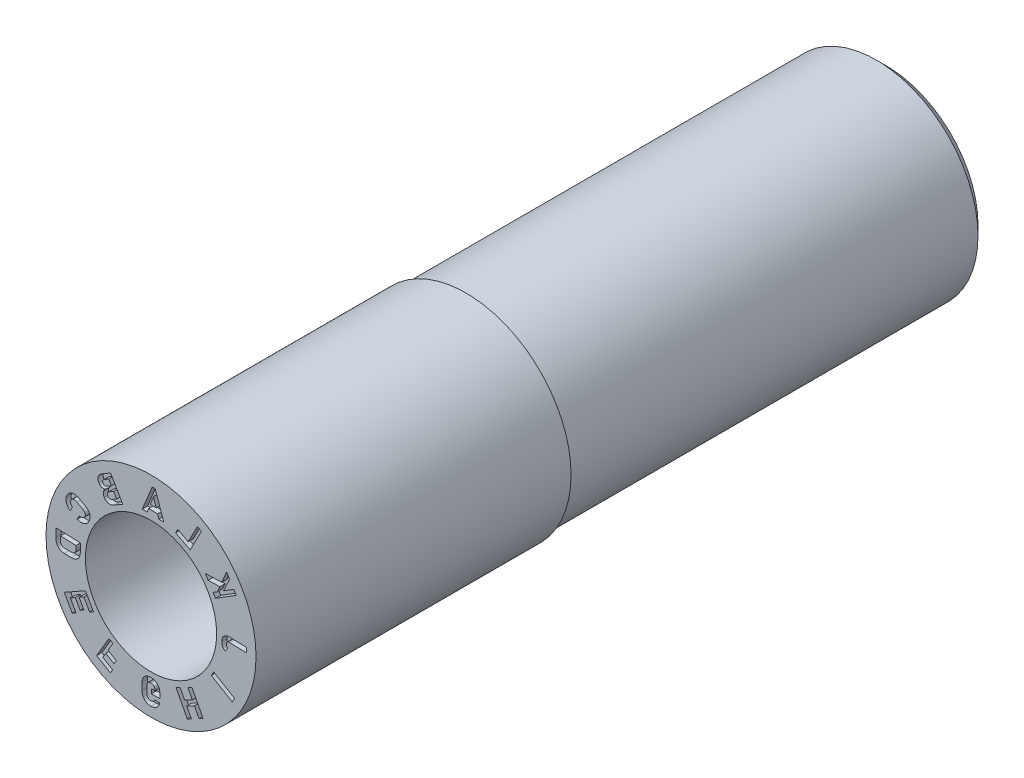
SolidWorks part; units mm, degrees
ref_plane "Front Plane" through (0, 0, 0) normal (0, 0, 1) x (1, 0, 0)
ref_plane "Top Plane" through (0, 0, 0) normal (0, 1, 0) x (1, 0, 0)
ref_plane "Right Plane" through (0, 0, 0) normal (1, 0, 0) x (0, 0, -1)
sketch "Sketch1" plane through (0, 0, 0) normal (1, 0, 0) x (0, 0, -1)
  line L2 (0, 2) -> (0, 1.25)
  line L3 (13.75, 2) -> (0, 2)
  line L4 (-3.7979, 0) -> (49996.2021, 0) construction
  line L8 (11, 0.7) -> (2.3, 0.7)
  line L9 (2.3, 1.25) -> (2.3, 0.7)
  line L10 (2.3, 1.25) -> (0, 1.25)
  line L12 (14, 1) -> (14, 1.75)
  line L16 (14, 1.75) -> (13.75, 2)
  line L17 (14, 1) -> (11, 1)
  line L18 (11, 0.7) -> (11, 1)
  dimension "D1" = 14
  dimension "D2" = 45
  dimension "D3" = 0.25
  dimension "D4" = 4
  dimension "D5" = 2.5
  dimension "D6" = 2.3
  dimension "D7" = 1.4
  dimension "D8" = 2
  dimension "D9" = 3
revolve "Revolve1" add sketch "Sketch1" angle 360 about L4
sketch "Sketch5" plane through (0, 0, 0) normal (1, 0, 0) x (0, 0, -1)
  line L0 (0, 0) -> (50000, 0) construction
  line L1 (0, 2) -> (0, -2) construction
  line L2 (6, 1.935) -> (14, 1.935)
  line L3 (6, 1.935) -> (6, 2.935)
  line L4 (6, 2.935) -> (14, 2.935)
  line L5 (14, 1.935) -> (14, 2.935)
  line L6 (14, -1.75) -> (14, 1.75) construction
  line L7 (13.75, 2) -> (0, 2) construction
  dimension "D1" = 6
  dimension "D2" = 0.065
  dimension "D3" = 1
revolve "Cut-Revolve1" cut sketch "Sketch5" angle 360 about L0
sketch "Sketch2" plane through (0, 0, 0) normal (0, 0, 1) x (1, 0, 0)
  line L0 (1.3812, 0.777) -> (1.4966, 1.0272)
  line L1 (1.4966, 1.0272) -> (1.4384, 1.1208)
  line L2 (1.4384, 1.1208) -> (1.3483, 0.9023)
  line L4 (1.623, 0.8241) -> (1.5767, 0.8985)
  line L5 (1.5767, 0.8985) -> (1.3812, 0.777)
  line L6 (1.182, 0.653) -> (1.2283, 0.5786)
  line L7 (1.2283, 0.5786) -> (1.623, 0.8241)
  line L8 (1.311, 0.8117) -> (1.2675, 0.7062)
  line L9 (1.3483, 0.9023) -> (1.0334, 0.8919)
  line L10 (1.0334, 0.8919) -> (1.0883, 0.8036)
  line L11 (1.0883, 0.8036) -> (1.311, 0.8117)
  line L12 (0.9605, 1.5481) -> (0.8828, 1.5886)
  line L13 (0.8828, 1.5886) -> (0.707, 1.251)
  line L15 (0.7457, 1.1356) -> (0.9605, 1.5481)
  line L16 (0.707, 1.251) -> (0.5084, 1.3544)
  line L17 (0.5084, 1.3544) -> (0.4693, 1.2795)
  line L18 (0.4693, 1.2795) -> (0.7457, 1.1356)
  line L20 (0.0794, 1.8106) -> (0.0239, 1.8122)
  line L21 (0.0239, 1.8122) -> (-0.1669, 1.3536)
  line L22 (-0.1669, 1.3536) -> (-0.0728, 1.3509)
  line L23 (-0.0728, 1.3509) -> (-0.0446, 1.4244)
  line L24 (0.0473, 1.6644) -> (0.0982, 1.5045)
  line L25 (0.1492, 1.3444) -> (0.2432, 1.3418)
  line L26 (0.2432, 1.3418) -> (0.0794, 1.8106)
  line L27 (0.0982, 1.5045) -> (-0.0127, 1.5077)
  line L28 (-0.7112, 1.3713) -> (-0.6555, 1.2753)
  line L29 (-0.0446, 1.4244) -> (0.1253, 1.4195)
  line L30 (0.1253, 1.4195) -> (0.1492, 1.3444)
  line L31 (-0.6555, 1.2753) -> (-0.7406, 1.2259)
  line L32 (-0.8224, 1.2419) -> (-0.8228, 1.2429)
  line L33 (-0.7964, 1.3219) -> (-0.7112, 1.3713)
  line L34 (-1.3691, -0.7036) -> (-1.2787, -0.6528)
  line L35 (-0.7534, 1.4439) -> (-0.8385, 1.3945)
  line L36 (-0.8882, 1.4801) -> (-0.8031, 1.5295)
  line L37 (-0.818, -1.3014) -> (-0.7245, -1.1427)
  line L38 (-0.77, 1.6457) -> (-0.9328, 1.5512)
  line L39 (-0.892, 1.1876) -> (-0.8916, 1.1867)
  line L40 (-0.7058, 1.1493) -> (-0.6741, 1.1676)
  line L41 (0.8268, -1.3944) -> (0.9151, -1.5638)
  line L43 (-0.8031, 1.5295) -> (-0.7534, 1.4439)
  line L44 (-0.6741, 1.1676) -> (-0.5383, 1.2465)
  line L45 (-0.5383, 1.2465) -> (-0.77, 1.6457)
  line L46 (-1.2573, 0.8653) -> (-1.3692, 0.926)
  line L47 (-1.5403, 0.6387) -> (-1.497, 0.7183)
  line L48 (-1.4125, 0.8464) -> (-1.3006, 0.7857)
  line L49 (-1.3623, 0.6452) -> (-1.4056, 0.5655)
  line L50 (-1.4288, 0.1216) -> (-1.4309, 0.0536)
  line L51 (-1.5131, -0.0341) -> (-1.6497, -0.0298)
  line L52 (-1.7262, 0.063) -> (-1.7241, 0.131)
  line L53 (0.641, -1.3967) -> (0.5545, -1.2307)
  line L54 (-1.8055, 0.2211) -> (-1.8104, 0.0677)
  line L55 (-1.6501, -0.1204) -> (-1.5186, -0.1246)
  line L56 (-1.3466, 0.0532) -> (-1.3418, 0.2063)
  line L57 (1.2675, 0.7062) -> (1.182, 0.653)
  line L59 (-1.7241, 0.131) -> (-1.4288, 0.1216)
  line L61 (-1.3418, 0.2063) -> (-1.8055, 0.2211)
  line L63 (-1.5355, -0.7973) -> (-1.4423, -0.7449)
  line L65 (-1.2482, -0.5355) -> (-1.6515, -0.7625)
  line L66 (-1.2787, -0.6528) -> (-1.1694, -0.8469)
  line L67 (-1.1694, -0.8469) -> (-1.0961, -0.8056)
  line L68 (-1.0961, -0.8056) -> (-1.2482, -0.5355)
  line L70 (-1.4423, -0.7449) -> (-1.3502, -0.9085)
  line L71 (-1.3502, -0.9085) -> (-1.277, -0.8672)
  line L72 (-1.277, -0.8672) -> (-1.3691, -0.7036)
  line L74 (-1.6515, -0.7625) -> (-1.4995, -1.0326)
  line L75 (-1.4995, -1.0326) -> (-1.4263, -0.9914)
  line L76 (-1.4263, -0.9914) -> (-1.5355, -0.7973)
  line L79 (-0.9173, -1.4698) -> (-0.8608, -1.3739)
  line L80 (-0.7245, -1.1427) -> (-0.7999, -1.0984)
  line L81 (-0.7999, -1.0984) -> (-1.0354, -1.4981)
  line L82 (-0.8608, -1.3739) -> (-0.7037, -1.4664)
  line L83 (-0.7037, -1.4664) -> (-0.661, -1.3939)
  line L84 (-0.661, -1.3939) -> (-0.818, -1.3014)
  line L86 (-1.0354, -1.4981) -> (-0.7729, -1.6527)
  line L87 (-0.7729, -1.6527) -> (-0.7301, -1.5801)
  line L88 (-0.7301, -1.5801) -> (-0.9173, -1.4698)
  line L90 (0.1682, -1.6069) -> (0.168, -1.5162)
  line L91 (-0.1713, -1.5063) -> (-0.1712, -1.6431)
  line L92 (0.1643, -1.6783) -> (0.0699, -1.6784)
  line L93 (-0.0806, -1.6431) -> (-0.0807, -1.5062)
  line L94 (0.0774, -1.5151) -> (0.0774, -1.5227)
  line L95 (0.0774, -1.5227) -> (0.0073, -1.5228)
  line L96 (0.0073, -1.5228) -> (0.0074, -1.607)
  line L97 (0.0074, -1.607) -> (0.1682, -1.6069)
  line L98 (0.9151, -1.5638) -> (0.9923, -1.5236)
  line L99 (0.9923, -1.5236) -> (0.7789, -1.1138)
  line L100 (0.7789, -1.1138) -> (0.7016, -1.1541)
  line L101 (0.7016, -1.1541) -> (0.7881, -1.3201)
  line L102 (0.6908, -1.6807) -> (0.7679, -1.6405)
  line L103 (0.7679, -1.6405) -> (0.6797, -1.471)
  line L104 (0.5545, -1.2307) -> (0.4774, -1.2709)
  line L105 (0.4774, -1.2709) -> (0.6908, -1.6807)
  line L106 (0.6797, -1.471) -> (0.8268, -1.3944)
  line L108 (0.7881, -1.3201) -> (0.641, -1.3967)
  line L110 (1.1943, -0.6555) -> (1.1481, -0.7334)
  line L111 (1.1481, -0.7334) -> (1.5472, -0.97)
  line L112 (1.5472, -0.97) -> (1.5934, -0.8921)
  line L113 (1.5934, -0.8921) -> (1.1943, -0.6555)
  line L114 (1.4082, -0.2013) -> (1.4621, -0.1312)
  line L115 (0, 0) -> (0, 2.3765) construction
  line L116 (0, 0) -> (1.1882, 2.0581) construction
  line L117 (0, 0) -> (2.0581, 1.1882) construction
  line L118 (0, 0) -> (2.3765, 0) construction
  line L119 (0, 0) -> (2.0581, -1.1882) construction
  line L120 (0, 0) -> (1.1882, -2.0581) construction
  line L121 (0, 0) -> (0, -2.3765) construction
  line L122 (0, 0) -> (-1.1882, -2.0581) construction
  line L123 (0, 0) -> (-2.0581, -1.1882) construction
  line L124 (0, 0) -> (-2.3765, 0) construction
  line L125 (0, 0) -> (-2.0581, 1.1882) construction
  line L126 (0, 0) -> (-1.1882, 2.0581) construction
  line L127 (1.5023, -0.0184) -> (1.8183, -0.027)
  line L128 (1.8183, -0.027) -> (1.8208, 0.0635)
  line L129 (1.8208, 0.0635) -> (1.5044, 0.0721)
  line L130 (-0.0127, 1.5077) -> (0.0473, 1.6644)
  circle A54 centre (0, 0) radius 1.3646 construction
  spline S0 degree 3 poles (-0.7406, 1.2259) (-0.7483, 1.2215) (-0.7602, 1.2161) (-0.7766, 1.2138) (-0.7878, 1.2148) (-0.7982, 1.218) (-0.8111, 1.226) (-0.8185, 1.2351) (-0.8224, 1.2419) knots 0 0 0 0 0.283177 0.406051 0.522898 0.636531 0.750638 1 1 1 1
  spline S1 degree 3 poles (-0.8228, 1.2429) (-0.8255, 1.2476) (-0.829, 1.2548) (-0.8312, 1.265) (-0.8316, 1.2722) (-0.8309, 1.2794) (-0.8294, 1.2863) (-0.8263, 1.293) (-0.8224, 1.2995) (-0.8174, 1.3057) (-0.8091, 1.3138) (-0.8016, 1.3188) (-0.7964, 1.3219) knots 0 0 0 0 0.172443 0.251642 0.328086 0.402715 0.47761 0.553924 0.633837 0.717732 0.805932 1 1 1 1
  spline S2 degree 3 poles (-0.8385, 1.3945) (-0.8454, 1.3905) (-0.8563, 1.3857) (-0.8712, 1.3839) (-0.8814, 1.3849) (-0.891, 1.3883) (-0.9031, 1.3958) (-0.9096, 1.4048) (-0.9135, 1.4111) knots 0 0 0 0 0.277909 0.398836 0.514793 0.628277 0.744294 1 1 1 1
  spline S3 degree 3 poles (-0.9135, 1.4111) (-0.9168, 1.4169) (-0.9207, 1.4263) (-0.9206, 1.4394) (-0.9184, 1.4487) (-0.9139, 1.4575) (-0.9048, 1.4693) (-0.895, 1.4759) (-0.8882, 1.4801) knots 0 0 0 0 0.243539 0.354356 0.466789 0.583916 0.708822 1 1 1 1
  spline S4 degree 3 poles (-0.9328, 1.5512) (-0.9449, 1.5443) (-0.9615, 1.5327) (-0.9804, 1.5145) (-0.9916, 1.5004) (-1.0005, 1.4858) (-1.007, 1.4706) (-1.0108, 1.4548) (-1.0121, 1.4386) (-1.011, 1.4221) (-1.0058, 1.3992) (-0.9985, 1.3826) (-0.9922, 1.3721) knots 0 0 0 0 0.194841 0.282947 0.366427 0.445852 0.522292 0.597128 0.672122 0.748837 0.828157 1 1 1 1
  spline S5 degree 3 poles (-0.9922, 1.3721) (-0.9878, 1.3648) (-0.9807, 1.3543) (-0.9687, 1.343) (-0.9592, 1.3359) (-0.949, 1.3303) (-0.9383, 1.326) (-0.9268, 1.3232) (-0.9149, 1.3219) (-0.9026, 1.322) (-0.8852, 1.3241) (-0.8722, 1.3278) (-0.8636, 1.331) knots 0 0 0 0 0.172529 0.253083 0.332554 0.410188 0.487931 0.566064 0.646434 0.729378 0.814892 1 1 1 1
  spline S6 degree 3 poles (-0.8636, 1.331) (-0.8713, 1.325) (-0.8818, 1.3153) (-0.8931, 1.3004) (-0.8996, 1.2889) (-0.9048, 1.277) (-0.908, 1.2648) (-0.9097, 1.2522) (-0.9095, 1.2395) (-0.9077, 1.2265) (-0.9029, 1.2087) (-0.8969, 1.1959) (-0.892, 1.1876) knots 0 0 0 0 0.18028 0.26392 0.345728 0.425166 0.503121 0.580165 0.658737 0.739149 0.822201 1 1 1 1
  spline S7 degree 3 poles (-0.8916, 1.1867) (-0.8854, 1.1761) (-0.8748, 1.1612) (-0.8572, 1.1454) (-0.8433, 1.1361) (-0.8285, 1.1291) (-0.8128, 1.1247) (-0.7963, 1.1226) (-0.7791, 1.1232) (-0.7613, 1.126) (-0.7361, 1.1334) (-0.7178, 1.1423) (-0.7058, 1.1493) knots 0 0 0 0 0.172357 0.251846 0.328866 0.404201 0.478853 0.555423 0.635018 0.718404 0.805968 1 1 1 1
  spline S8 degree 3 poles (-1.1854, 0.6351) (-1.1814, 0.6426) (-1.1758, 0.6539) (-1.17, 0.6694) (-1.1663, 0.6806) (-1.1635, 0.6918) (-1.1615, 0.7028) (-1.1604, 0.7137) (-1.1599, 0.7245) (-1.1602, 0.7351) (-1.1614, 0.7455) (-1.1632, 0.7557) (-1.166, 0.7656) (-1.1693, 0.7754) (-1.1736, 0.7849) (-1.1785, 0.7943) (-1.1843, 0.8034) (-1.1908, 0.8122) (-1.1982, 0.8206) (-1.2061, 0.829) (-1.215, 0.8368) (-1.2245, 0.8445) (-1.2384, 0.8543) (-1.2496, 0.861) (-1.2573, 0.8653) knots 0 0 0 0 0.093263 0.13764 0.18074 0.222667 0.263368 0.303292 0.342581 0.381223 0.419433 0.457118 0.494381 0.531982 0.569989 0.608386 0.647662 0.687699 0.728383 0.77014 0.813349 0.857582 0.903517 1 1 1 1
  spline S9 degree 3 poles (-1.3692, 0.926) (-1.377, 0.9303) (-1.3887, 0.9359) (-1.4046, 0.9423) (-1.4162, 0.946) (-1.4275, 0.9492) (-1.4388, 0.9514) (-1.45, 0.9528) (-1.461, 0.9535) (-1.4717, 0.9534) (-1.4823, 0.9525) (-1.4926, 0.951) (-1.5027, 0.9486) (-1.5125, 0.9453) (-1.5222, 0.9415) (-1.5315, 0.9368) (-1.5406, 0.9313) (-1.5495, 0.9251) (-1.5579, 0.9181) (-1.5661, 0.9104) (-1.5739, 0.902) (-1.5814, 0.8928) (-1.5911, 0.8794) (-1.5977, 0.8687) (-1.6017, 0.8612) knots 0 0 0 0 0.096578 0.142249 0.186561 0.229482 0.271363 0.312409 0.352283 0.391447 0.430114 0.467872 0.505557 0.543308 0.580854 0.618955 0.657544 0.696822 0.736672 0.777602 0.819526 0.862539 0.906791 1 1 1 1
  spline S10 degree 3 poles (-1.6017, 0.8612) (-1.6083, 0.849) (-1.6164, 0.8299) (-1.6215, 0.8033) (-1.6229, 0.7836) (-1.6216, 0.764) (-1.6176, 0.7446) (-1.611, 0.7256) (-1.6018, 0.7069) (-1.59, 0.6888) (-1.5706, 0.6647) (-1.553, 0.6487) (-1.5403, 0.6387) knots 0 0 0 0 0.164327 0.242586 0.319786 0.397014 0.474298 0.553007 0.634808 0.719759 0.808514 1 1 1 1
  spline S11 degree 3 poles (-1.497, 0.7183) (-1.5027, 0.7231) (-1.5103, 0.7309) (-1.5189, 0.7421) (-1.524, 0.7507) (-1.528, 0.7593) (-1.5311, 0.7679) (-1.5329, 0.7767) (-1.5336, 0.7855) (-1.5333, 0.7942) (-1.531, 0.8058) (-1.5279, 0.8142) (-1.5248, 0.8195) knots 0 0 0 0 0.19458 0.285089 0.372105 0.454905 0.535045 0.612398 0.689463 0.765515 0.841075 1 1 1 1
  spline S12 degree 3 poles (-1.5248, 0.8195) (-1.5212, 0.8262) (-1.5149, 0.8355) (-1.5046, 0.8458) (-1.4963, 0.8517) (-1.4874, 0.8563) (-1.4779, 0.8592) (-1.4679, 0.8608) (-1.4574, 0.8609) (-1.4466, 0.8595) (-1.4312, 0.8553) (-1.4199, 0.8506) (-1.4125, 0.8464) knots 0 0 0 0 0.174576 0.254606 0.331699 0.406966 0.481706 0.558069 0.637336 0.720087 0.807714 1 1 1 1
  spline S13 degree 3 poles (-1.3006, 0.7857) (-1.2932, 0.7817) (-1.2829, 0.7749) (-1.2711, 0.7642) (-1.2641, 0.7559) (-1.2586, 0.7471) (-1.2545, 0.7379) (-1.252, 0.7283) (-1.2509, 0.7184) (-1.2514, 0.7082) (-1.2543, 0.694) (-1.2586, 0.6835) (-1.2623, 0.6768) knots 0 0 0 0 0.193323 0.280391 0.363186 0.441772 0.517736 0.59205 0.667164 0.744174 0.824716 1 1 1 1
  spline S14 degree 3 poles (-1.2623, 0.6768) (-1.2652, 0.6715) (-1.2704, 0.6639) (-1.2791, 0.6557) (-1.2861, 0.6504) (-1.2938, 0.6463) (-1.3021, 0.6429) (-1.311, 0.6407) (-1.3204, 0.6395) (-1.3303, 0.6393) (-1.3445, 0.6404) (-1.3552, 0.643) (-1.3623, 0.6452) knots 0 0 0 0 0.160107 0.236417 0.312415 0.388471 0.465746 0.544991 0.627212 0.713455 0.803972 1 1 1 1
  spline S15 degree 3 poles (-1.4056, 0.5655) (-1.3902, 0.5603) (-1.3671, 0.5545) (-1.3363, 0.5513) (-1.3147, 0.5514) (-1.294, 0.5538) (-1.2745, 0.5586) (-1.2561, 0.5658) (-1.2389, 0.5752) (-1.2232, 0.587) (-1.2036, 0.6057) (-1.1921, 0.6229) (-1.1854, 0.6351) knots 0 0 0 0 0.191937 0.280787 0.365796 0.447661 0.526184 0.603468 0.680472 0.757424 0.835658 1 1 1 1
  spline S16 degree 3 poles (-1.4309, 0.0536) (-1.4311, 0.0468) (-1.432, 0.0369) (-1.4347, 0.0243) (-1.437, 0.0157) (-1.4404, 0.0078) (-1.4441, 0.0004) (-1.4485, -0.0064) (-1.4536, -0.0124) (-1.4593, -0.0177) (-1.4654, -0.0224) (-1.4721, -0.0263) (-1.4793, -0.0294) (-1.487, -0.0317) (-1.4983, -0.034) (-1.5071, -0.0343) (-1.5131, -0.0341) knots 0 0 0 0 0.148914 0.217405 0.28322 0.345357 0.405771 0.464641 0.52207 0.578854 0.634762 0.691563 0.748186 0.807299 0.868222 1 1 1 1
  spline S17 degree 3 poles (-1.6497, -0.0298) (-1.6556, -0.0295) (-1.6645, -0.0287) (-1.6756, -0.0258) (-1.6831, -0.0229) (-1.6902, -0.0193) (-1.6966, -0.0151) (-1.7025, -0.01) (-1.7078, -0.0043) (-1.7124, 0.0021) (-1.7165, 0.009) (-1.7197, 0.0166) (-1.7224, 0.0248) (-1.7244, 0.0335) (-1.7261, 0.0463) (-1.7265, 0.0562) (-1.7262, 0.063) knots 0 0 0 0 0.131618 0.192912 0.251526 0.30945 0.365197 0.42148 0.478703 0.53616 0.594459 0.654456 0.717115 0.782747 0.851228 1 1 1 1
  spline S18 degree 3 poles (-1.8104, 0.0677) (-1.8108, 0.0584) (-1.8104, 0.0446) (-1.8091, 0.0266) (-1.8074, 0.0139) (-1.8051, 0.0016) (-1.802, -0.0101) (-1.7985, -0.0213) (-1.7943, -0.032) (-1.7894, -0.042) (-1.7841, -0.0517) (-1.778, -0.0605) (-1.7714, -0.0689) (-1.7644, -0.0767) (-1.7567, -0.0838) (-1.7484, -0.0903) (-1.7394, -0.0962) (-1.73, -0.1016) (-1.72, -0.1062) (-1.7096, -0.1102) (-1.6986, -0.1135) (-1.6872, -0.1163) (-1.671, -0.1192) (-1.6585, -0.1201) (-1.6501, -0.1204) knots 0 0 0 0 0.09984 0.147051 0.192674 0.236787 0.279949 0.321464 0.362368 0.402107 0.44099 0.479321 0.516928 0.554256 0.591534 0.629019 0.666964 0.705455 0.744411 0.78418 0.82495 0.866567 0.909521 1 1 1 1
  spline S19 degree 3 poles (-1.5186, -0.1246) (-1.5105, -0.1248) (-1.4985, -0.1247) (-1.4829, -0.123) (-1.4717, -0.1211) (-1.4609, -0.1184) (-1.4504, -0.1152) (-1.4403, -0.1113) (-1.4306, -0.1069) (-1.4214, -0.1017) (-1.4125, -0.096) (-1.4043, -0.0894) (-1.3965, -0.0822) (-1.3892, -0.0744) (-1.3824, -0.0658) (-1.3762, -0.0567) (-1.3704, -0.0469) (-1.3652, -0.0365) (-1.3607, -0.0254) (-1.3567, -0.0138) (-1.3533, -0.0015) (-1.3507, 0.0113) (-1.348, 0.0296) (-1.3468, 0.0436) (-1.3466, 0.0532) knots 0 0 0 0 0.086518 0.127857 0.168353 0.207852 0.246738 0.285295 0.323256 0.360976 0.398475 0.435656 0.473276 0.511549 0.550019 0.589564 0.629909 0.671546 0.713806 0.757737 0.80276 0.849318 0.897624 1 1 1 1
  spline S20 degree 3 poles (0.168, -1.5162) (0.1681, -1.5079) (0.1673, -1.4955) (0.1653, -1.4793) (0.1629, -1.4677) (0.16, -1.4565) (0.1563, -1.4457) (0.1521, -1.4353) (0.1472, -1.4252) (0.1417, -1.4157) (0.1357, -1.4067) (0.129, -1.3982) (0.1219, -1.3903) (0.1142, -1.3829) (0.106, -1.3761) (0.0972, -1.37) (0.0879, -1.3642) (0.0781, -1.3592) (0.068, -1.3548) (0.0574, -1.3511) (0.0465, -1.348) (0.0352, -1.3458) (0.0194, -1.3434) (0.0073, -1.3429) (-0.0009, -1.3429) knots 0 0 0 0 0.092005 0.13606 0.179552 0.221828 0.263577 0.304759 0.34567 0.386201 0.425893 0.465128 0.50438 0.543105 0.582236 0.621552 0.661368 0.701815 0.742172 0.783266 0.824629 0.867033 0.910108 1 1 1 1
  spline S21 degree 3 poles (-0.0009, -1.3429) (-0.0091, -1.343) (-0.0212, -1.3433) (-0.0371, -1.3457) (-0.0485, -1.3478) (-0.0595, -1.3508) (-0.0701, -1.3542) (-0.0804, -1.3583) (-0.0902, -1.3631) (-0.0997, -1.3684) (-0.1085, -1.3743) (-0.1168, -1.3807) (-0.1247, -1.3876) (-0.1318, -1.3951) (-0.1387, -1.403) (-0.1447, -1.4116) (-0.1503, -1.4205) (-0.1552, -1.4299) (-0.1595, -1.4398) (-0.1633, -1.4499) (-0.1662, -1.4605) (-0.1685, -1.4714) (-0.1707, -1.4867) (-0.1713, -1.4984) (-0.1713, -1.5063) knots 0 0 0 0 0.092544 0.137065 0.18048 0.223144 0.265393 0.30683 0.347988 0.388887 0.428602 0.468118 0.507127 0.546078 0.585159 0.624399 0.664134 0.704183 0.744448 0.784914 0.826206 0.867948 0.911013 1 1 1 1
  spline S22 degree 3 poles (-0.1712, -1.6431) (-0.1711, -1.6515) (-0.1705, -1.6639) (-0.1682, -1.6801) (-0.1661, -1.6917) (-0.163, -1.7028) (-0.1595, -1.7137) (-0.1551, -1.7241) (-0.1503, -1.7341) (-0.1448, -1.7437) (-0.1387, -1.7526) (-0.1322, -1.761) (-0.125, -1.7689) (-0.1173, -1.7762) (-0.1091, -1.7831) (-0.1003, -1.7892) (-0.091, -1.7949) (-0.0812, -1.8) (-0.0711, -1.8044) (-0.0605, -1.8079) (-0.0497, -1.8111) (-0.0384, -1.8133) (-0.0226, -1.8157) (-0.0105, -1.8162) (-0.0023, -1.8162) knots 0 0 0 0 0.092106 0.136601 0.179732 0.222142 0.263826 0.305186 0.346142 0.386543 0.42599 0.465268 0.504306 0.543073 0.582246 0.621605 0.661762 0.701943 0.742344 0.783371 0.824778 0.866888 0.91001 1 1 1 1
  spline S23 degree 3 poles (-0.0023, -1.8162) (0.011, -1.8162) (0.031, -1.8142) (0.0564, -1.807) (0.0743, -1.7995) (0.0912, -1.7901) (0.1065, -1.7787) (0.1206, -1.7657) (0.1331, -1.7509) (0.1439, -1.7346) (0.1558, -1.7108) (0.1617, -1.6915) (0.1643, -1.6783) knots 0 0 0 0 0.170685 0.253413 0.336186 0.417811 0.498757 0.579437 0.661794 0.744424 0.82792 1 1 1 1
  spline S24 degree 3 poles (0.0699, -1.6784) (0.0683, -1.6832) (0.0653, -1.6901) (0.0594, -1.6983) (0.0544, -1.7039) (0.0486, -1.7089) (0.0424, -1.7134) (0.0356, -1.7171) (0.0285, -1.7202) (0.021, -1.7227) (0.0107, -1.7249) (0.0029, -1.7256) (-0.0024, -1.7256) knots 0 0 0 0 0.163364 0.243452 0.326083 0.408803 0.490913 0.574333 0.659149 0.744285 0.829224 1 1 1 1
  spline S25 degree 3 poles (-0.0024, -1.7256) (-0.0098, -1.7256) (-0.0206, -1.7245) (-0.0342, -1.7202) (-0.0435, -1.7157) (-0.0519, -1.71) (-0.0593, -1.7032) (-0.0657, -1.6953) (-0.0711, -1.6865) (-0.0754, -1.6767) (-0.0794, -1.6623) (-0.0807, -1.6509) (-0.0806, -1.6431) knots 0 0 0 0 0.172667 0.25321 0.333442 0.412676 0.490536 0.568703 0.649223 0.732494 0.817769 1 1 1 1
  spline S26 degree 3 poles (-0.0807, -1.5062) (-0.0807, -1.4994) (-0.0797, -1.4892) (-0.0754, -1.4765) (-0.071, -1.4679) (-0.0656, -1.46) (-0.059, -1.4531) (-0.0514, -1.4472) (-0.0428, -1.4422) (-0.0334, -1.4383) (-0.0194, -1.4344) (-0.0083, -1.4335) (-0.0008, -1.4335) knots 0 0 0 0 0.169109 0.249374 0.32852 0.406674 0.484643 0.562592 0.644334 0.727807 0.814063 1 1 1 1
  spline S27 degree 3 poles (-0.0008, -1.4335) (0.0066, -1.4335) (0.0176, -1.4346) (0.0313, -1.4387) (0.0406, -1.443) (0.049, -1.4484) (0.0564, -1.455) (0.0629, -1.4626) (0.0681, -1.4714) (0.0723, -1.4811) (0.0764, -1.4956) (0.0773, -1.5072) (0.0774, -1.5151) knots 0 0 0 0 0.17427 0.256124 0.335844 0.413975 0.489918 0.567537 0.647158 0.729279 0.814679 1 1 1 1
  spline S28 degree 3 poles (1.3482, -0.0717) (1.3477, -0.0852) (1.3492, -0.1052) (1.3554, -0.1307) (1.3623, -0.1482) (1.371, -0.1642) (1.385, -0.1834) (1.3985, -0.1949) (1.4082, -0.2013) knots 0 0 0 0 0.272169 0.400605 0.52571 0.647863 0.766017 1 1 1 1
  spline S29 degree 3 poles (1.4621, -0.1312) (1.4574, -0.1274) (1.4511, -0.1209) (1.4443, -0.111) (1.4401, -0.1031) (1.4369, -0.0949) (1.4337, -0.0837) (1.4331, -0.0749) (1.4332, -0.0691) knots 0 0 0 0 0.255158 0.381526 0.507704 0.632352 0.754583 1 1 1 1
  spline S30 degree 3 poles (1.4332, -0.0691) (1.4332, -0.0615) (1.4357, -0.0503) (1.4437, -0.0377) (1.4519, -0.0302) (1.462, -0.0246) (1.4788, -0.0189) (1.4927, -0.0182) (1.5023, -0.0184) knots 0 0 0 0 0.235745 0.344346 0.456618 0.574942 0.702083 1 1 1 1
  spline S31 degree 3 poles (1.5044, 0.0721) (1.4894, 0.0726) (1.4675, 0.0713) (1.4399, 0.0647) (1.4245, 0.0586) (1.4132, 0.0527) (1.4052, 0.0479) (1.3978, 0.0425) (1.3909, 0.0365) (1.3844, 0.0302) (1.3785, 0.0232) (1.3731, 0.0158) (1.3681, 0.0079) (1.3636, -0.0005) (1.3599, -0.0094) (1.3565, -0.0187) (1.3537, -0.0284) (1.3514, -0.0386) (1.3493, -0.053) (1.3483, -0.0641) (1.3482, -0.0717) knots 0 0 0 0 0.186082 0.270785 0.351715 0.390855 0.429404 0.467249 0.50518 0.5426 0.580025 0.618246 0.656801 0.696035 0.736036 0.776906 0.818688 0.861935 0.90638 1 1 1 1
  point P239 (0, 0)
  dimension "D1" = 12
extrude "Cut-Extrude1" cut sketch "Sketch2" against normal blind 0.1
sketch "Sketch3" plane through (0, 0, -2.3) normal (0, 0, 1) x (1, 0, 0)
  line L0 (0, 0) -> (0, 50000) construction
  line L1 (0.4041, 0.7) -> (-0.4041, 0.7)
  line L2 (-0.4041, 0.7) -> (-0.8083, 0)
  line L3 (-0.8083, 0) -> (-0.4041, -0.7)
  line L4 (-0.4041, -0.7) -> (0.4041, -0.7)
  line L5 (0.4041, -0.7) -> (0.8083, 0)
  line L6 (0.8083, 0) -> (0.4041, 0.7)
  line L7 (0, 0) -> (50000, 0) construction
  circle A0 centre (0, 0) radius 0.7 construction
  circle A1 centre (0, 0) radius 0.7 construction
extrude "Cut-Extrude2" cut sketch "Sketch3" against normal blind 1.4
